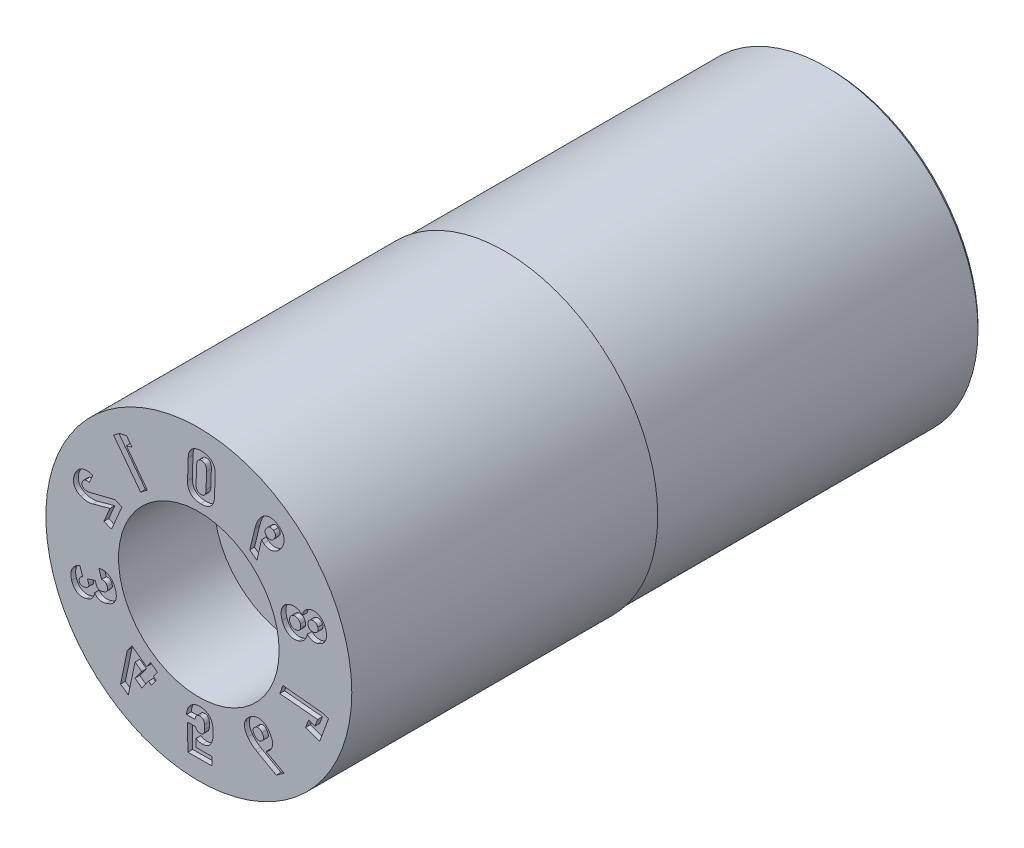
SolidWorks part; units mm, degrees
ref_plane "Front Plane" through (0, 0, 0) normal (0, 0, 1) x (1, 0, 0)
ref_plane "Top Plane" through (0, 0, 0) normal (0, 1, 0) x (1, 0, 0)
ref_plane "Right Plane" through (0, 0, 0) normal (1, 0, 0) x (0, 0, -1)
sketch "Sketch1" plane through (0, 0, 0) normal (1, 0, 0) x (0, 0, -1)
  line L2 (0, 8) -> (0, 4.2)
  line L3 (32.75, 8) -> (0, 8)
  line L4 (-3.7979, 0) -> (49996.2021, 0) construction
  line L8 (25, 1.75) -> (5, 1.75)
  line L9 (5, 4.2) -> (5, 1.75)
  line L10 (5, 4.2) -> (0, 4.2)
  line L12 (33, 4) -> (33, 7.75)
  line L16 (33, 7.75) -> (32.75, 8)
  line L17 (33, 4) -> (25, 4)
  line L18 (25, 1.75) -> (25, 4)
  dimension "D1" = 33
  dimension "D2" = 45
  dimension "D3" = 0.25
  dimension "D4" = 16
  dimension "D5" = 8.4
  dimension "D6" = 5
  dimension "D7" = 3.5
  dimension "D8" = 8
  dimension "D9" = 8
revolve "Revolve1" add sketch "Sketch1" angle 360 about L4
sketch "Sketch4" plane through (0, 0, 0) normal (1, 0, 0) x (0, 0, -1)
  line L0 (0, 0) -> (50000, 0) construction
  line L1 (33, -7.75) -> (33, 7.75) construction
  line L2 (16, 8.935) -> (33, 8.935)
  line L3 (16, 8.935) -> (16, 7.935)
  line L4 (16, 7.935) -> (33, 7.935)
  line L5 (33, 8.935) -> (33, 7.935)
  line L6 (32.75, 8) -> (0, 8) construction
  line L9 (0, 8.8) -> (0, -8.8) construction
  dimension "D1" = 1
  dimension "D2" = 0.065
  dimension "D3" = 16
revolve "Cut-Revolve1" cut sketch "Sketch4" angle 360 about L0
sketch "Sketch2" plane through (0, 0, 0) normal (0, 0, 1) x (1, 0, 0)
  line L0 (0, 0) -> (0, 9.8705) construction
  line L1 (0, 0) -> (5.8017, 7.9854) construction
  line L2 (0, 0) -> (9.3874, 3.0502) construction
  line L3 (0, 0) -> (9.3874, -3.0502) construction
  line L4 (0, 0) -> (5.8017, -7.9854) construction
  line L5 (0, 0) -> (0, -9.8705) construction
  line L6 (0, 0) -> (-5.8017, -7.9854) construction
  line L7 (0, 0) -> (-9.3874, -3.0502) construction
  line L8 (0, 0) -> (-9.3874, 3.0502) construction
  line L9 (0, 0) -> (-5.8017, 7.9854) construction
  line L10 (5.2105, 0.9555) -> (5.2468, 0.9678)
  line L11 (6.2049, 1.3375) -> (6.2628, 1.357)
  line L12 (5.8234, 2.6754) -> (5.7655, 2.6559)
  line L13 (4.7772, 2.3776) -> (4.7408, 2.3653)
  line L14 (4.9412, 1.9669) -> (4.9628, 1.9741)
  line L15 (5.1518, 1.4016) -> (5.1288, 1.3939)
  line L16 (5.8885, 2.2312) -> (5.9097, 2.2381)
  line L17 (6.0679, 1.7577) -> (6.0449, 1.75)
  line L18 (-2.7343, -4.1859) -> (-3.4994, -3.6238)
  line L19 (4.2834, 4.6581) -> (4.2845, 4.6594)
  line L20 (3.1715, 5.4731) -> (3.1707, 5.4723)
  line L21 (2.9229, 4.8591) -> (2.6616, 3.7971)
  line L22 (2.6616, 3.7971) -> (3.0391, 3.5179)
  line L23 (3.0391, 3.5179) -> (3.2791, 4.57)
  line L24 (3.54, 5.2247) -> (3.541, 5.2265)
  line L25 (3.9345, 4.9326) -> (3.9334, 4.9312)
  line L26 (0.8183, 5.2516) -> (0.8526, 6.3211)
  line L27 (-0.5549, 6.3667) -> (-0.5891, 5.2972)
  line L28 (-0.1422, 5.3963) -> (-0.1149, 6.239)
  line L29 (0.4057, 6.2224) -> (0.3784, 5.3797)
  line L30 (-3.0441, 3.5633) -> (-2.6908, 3.829)
  line L31 (-2.6908, 3.829) -> (-3.7895, 5.2888)
  line L32 (-3.7895, 5.2888) -> (-3.4964, 5.3743)
  line L33 (-3.4964, 5.3743) -> (-3.7789, 5.7494)
  line L34 (-3.7789, 5.7494) -> (-4.1539, 5.6655)
  line L35 (-4.1539, 5.6655) -> (-4.4556, 5.4383)
  line L36 (-4.4556, 5.4383) -> (-3.0441, 3.5633)
  line L37 (-4.3918, 2.551) -> (-5.6812, 2.2237)
  line L38 (-5.9891, 2.2302) -> (-5.9919, 2.2315)
  line L39 (-5.7263, 2.6573) -> (-5.7249, 2.6566)
  line L40 (-5.7249, 2.6566) -> (-5.5479, 3.0743)
  line L41 (-5.5479, 3.0743) -> (-5.5492, 3.075)
  line L42 (-6.1815, 1.8175) -> (-6.1801, 1.8168)
  line L43 (-5.5438, 1.7761) -> (-4.6458, 2.0224)
  line L44 (-4.6458, 2.0224) -> (-4.9596, 1.2842)
  line L45 (-4.9596, 1.2842) -> (-4.5673, 1.1175)
  line L46 (-4.5673, 1.1175) -> (-4.0247, 2.3951)
  line L47 (-4.0247, 2.3951) -> (-4.3918, 2.551)
  line L48 (-5.2305, -0.9771) -> (-5.0868, -1.4125)
  line L49 (-4.965, -1.9115) -> (-5.0178, -1.9286)
  line L50 (-5.3511, -1.8119) -> (-5.4138, -1.6222)
  line L51 (-5.4138, -1.6222) -> (-5.8203, -1.7563)
  line L52 (-5.8203, -1.7563) -> (-5.7577, -1.946)
  line L53 (-5.9335, -2.1893) -> (-5.9714, -2.2022)
  line L54 (-6.0754, -1.7774) -> (-6.2186, -1.3433)
  line L55 (-5.8659, -2.669) -> (-5.798, -2.6463)
  line L56 (-4.836, -2.371) -> (-4.7678, -2.3487)
  line L57 (-3.7405, -3.9523) -> (-4.0925, -5.6556)
  line L58 (-4.0925, -5.6556) -> (-3.6887, -5.9522)
  line L59 (-3.6887, -5.9522) -> (-3.3323, -4.2763)
  line L60 (-3.3323, -4.2763) -> (-2.9869, -4.5299)
  line L61 (-2.4816, -4.9011) -> (-2.2291, -4.557)
  line L62 (-2.2291, -4.557) -> (-2.3775, -4.448)
  line L63 (-3.4994, -3.6238) -> (-3.7405, -3.9523)
  line L64 (-3.3391, -5.0095) -> (-2.9824, -5.2717)
  line L65 (-2.9824, -5.2717) -> (-2.6301, -4.792)
  line L66 (-2.1632, -4.1563) -> (-2.5199, -3.894)
  line L67 (-2.5199, -3.894) -> (-2.7343, -4.1859)
  line L68 (-0.6419, -5.3092) -> (-0.6419, -5.3106)
  line L69 (-0.6419, -5.3106) -> (-0.1983, -5.3064)
  line L70 (-0.1983, -5.3064) -> (-0.1983, -5.3049)
  line L71 (0.2984, -5.3179) -> (0.3006, -5.515)
  line L72 (-0.1728, -5.6249) -> (-0.5872, -5.6291)
  line L73 (-0.5872, -5.6291) -> (-0.5745, -6.9821)
  line L74 (-0.5745, -6.9821) -> (0.6898, -6.9701)
  line L75 (0.6898, -6.9701) -> (0.6858, -6.5427)
  line L76 (0.6858, -6.5427) -> (-0.1348, -6.5505)
  line L77 (-0.1348, -6.5505) -> (-0.1385, -6.1347)
  line L78 (0.7437, -5.5108) -> (0.7416, -5.3137)
  line L79 (2.5522, -4.7219) -> (2.5532, -4.7233)
  line L80 (3.0678, -5.1612) -> (4.0497, -5.7117)
  line L81 (4.0497, -5.7117) -> (4.4602, -5.4187)
  line L82 (4.4602, -5.4187) -> (3.5177, -4.9024)
  line L84 (3.6846, -3.9264) -> (3.6836, -3.925)
  line L85 (3.305, -4.161) -> (3.306, -4.1623)
  line L86 (2.9039, -4.447) -> (2.9028, -4.4457)
  line L87 (6.5066, -1.6872) -> (4.3991, -1.4729)
  line L88 (4.3991, -1.4729) -> (4.2341, -1.9224)
  line L89 (4.2341, -1.9224) -> (6.2115, -2.1061)
  line L90 (6.2115, -2.1061) -> (6.0723, -2.4845)
  line L91 (6.0723, -2.4845) -> (5.7406, -2.363)
  line L92 (5.7406, -2.363) -> (5.5884, -2.7781)
  line L93 (5.5884, -2.7781) -> (6.3196, -3.0466)
  line L94 (6.3196, -3.0466) -> (6.7819, -1.7884)
  line L95 (6.7819, -1.7884) -> (6.5066, -1.6872)
  line L96 (-2.3775, -4.448) -> (-2.1632, -4.1563)
  line L97 (-2.6301, -4.792) -> (-2.4816, -4.9011)
  line L98 (-2.9869, -4.5299) -> (-3.3391, -5.0095)
  circle A0 centre (0, 0) radius 4.71 construction
  spline S0 degree 3 poles (4.3574, 1.4544) (4.3797, 1.3879) (4.4209, 1.2932) (4.494, 1.1805) (4.5555, 1.1086) (4.6224, 1.0465) (4.6958, 0.9968) (4.7735, 0.9581) (4.856, 0.9321) (4.942, 0.9182) (5.0622, 0.9166) (5.152, 0.9364) (5.2105, 0.9555) knots 0 0 0 0 0.189149 0.276864 0.361539 0.443576 0.522394 0.599725 0.677022 0.754789 0.833795 1 1 1 1
  spline S1 degree 3 poles (5.2468, 0.9678) (5.3018, 0.9857) (5.3802, 1.0246) (5.471, 1.0979) (5.5317, 1.1627) (5.5835, 1.2351) (5.6394, 1.3387) (5.6622, 1.4244) (5.6702, 1.4822) knots 0 0 0 0 0.246977 0.370172 0.497924 0.625566 0.750117 1 1 1 1
  spline S2 degree 3 poles (5.6702, 1.4822) (5.7052, 1.4465) (5.7644, 1.4002) (5.8533, 1.3555) (5.9234, 1.3313) (5.9952, 1.3165) (6.0903, 1.3104) (6.1606, 1.3229) (6.2049, 1.3375) knots 0 0 0 0 0.257134 0.383027 0.511099 0.637625 0.759671 1 1 1 1
  spline S3 degree 3 poles (6.2628, 1.357) (6.3178, 1.3758) (6.3968, 1.4114) (6.4866, 1.4806) (6.5434, 1.5398) (6.5917, 1.6057) (6.6286, 1.6787) (6.6558, 1.7572) (6.6717, 1.8412) (6.6777, 1.9295) (6.6704, 2.0549) (6.6472, 2.1487) (6.6268, 2.2107) knots 0 0 0 0 0.16714 0.246142 0.324291 0.402157 0.479801 0.558525 0.640149 0.724487 0.812253 1 1 1 1
  spline S4 degree 3 poles (6.6268, 2.2107) (6.6058, 2.2726) (6.5682, 2.3617) (6.4987, 2.4665) (6.4411, 2.5337) (6.3778, 2.5912) (6.309, 2.6376) (6.2355, 2.6735) (6.1577, 2.6978) (6.0765, 2.7108) (5.9633, 2.7116) (5.8785, 2.6938) (5.8234, 2.6754) knots 0 0 0 0 0.188263 0.275658 0.360332 0.441745 0.520456 0.597882 0.675873 0.753814 0.833078 1 1 1 1
  spline S5 degree 3 poles (5.7655, 2.6559) (5.7201, 2.6417) (5.6568, 2.6076) (5.5827, 2.5461) (5.5347, 2.4901) (5.4932, 2.4284) (5.4505, 2.338) (5.4317, 2.265) (5.4262, 2.2149) knots 0 0 0 0 0.242123 0.364086 0.490249 0.617698 0.743096 1 1 1 1
  spline S6 degree 3 poles (5.4262, 2.2149) (5.3847, 2.2572) (5.3141, 2.3122) (5.2067, 2.3632) (5.1217, 2.3905) (5.0345, 2.4065) (4.918, 2.4112) (4.832, 2.3955) (4.7772, 2.3776) knots 0 0 0 0 0.252199 0.377454 0.505058 0.631379 0.754394 1 1 1 1
  spline S7 degree 3 poles (4.7408, 2.3653) (4.6824, 2.3455) (4.5989, 2.3072) (4.5034, 2.234) (4.4432, 2.1711) (4.3926, 2.1008) (4.3534, 2.0234) (4.3256, 1.9395) (4.308, 1.85) (4.3024, 1.7555) (4.3112, 1.6213) (4.335, 1.5208) (4.3574, 1.4544) knots 0 0 0 0 0.166586 0.245064 0.32325 0.400569 0.477895 0.55635 0.638171 0.723193 0.810971 1 1 1 1
  spline S8 degree 3 poles (4.7615, 1.5889) (4.7527, 1.6154) (4.7432, 1.6561) (4.7418, 1.7104) (4.7449, 1.7493) (4.7537, 1.7864) (4.7671, 1.8214) (4.7859, 1.8537) (4.8088, 1.8835) (4.8364, 1.9103) (4.8792, 1.9412) (4.9153, 1.959) (4.9412, 1.9669) knots 0 0 0 0 0.178659 0.263512 0.345804 0.426862 0.506071 0.58371 0.664092 0.745271 0.827853 1 1 1 1
  spline S9 degree 3 poles (4.9628, 1.9741) (4.9864, 1.982) (5.0229, 1.9896) (5.0715, 1.9883) (5.1063, 1.9823) (5.1397, 1.9714) (5.1714, 1.9558) (5.2009, 1.9356) (5.2285, 1.9112) (5.253, 1.882) (5.2837, 1.8372) (5.2996, 1.7984) (5.3088, 1.7715) knots 0 0 0 0 0.166218 0.24509 0.322722 0.400755 0.478423 0.557267 0.638758 0.723097 0.810568 1 1 1 1
  spline S10 degree 3 poles (5.3088, 1.7715) (5.3174, 1.7446) (5.328, 1.7041) (5.3306, 1.6498) (5.3279, 1.6116) (5.3213, 1.5751) (5.3095, 1.5409) (5.2933, 1.5093) (5.2726, 1.4806) (5.2481, 1.4548) (5.2094, 1.425) (5.1756, 1.4093) (5.1518, 1.4016) knots 0 0 0 0 0.188381 0.275514 0.359781 0.441669 0.521149 0.598996 0.676873 0.75539 0.833936 1 1 1 1
  spline S11 degree 3 poles (5.1288, 1.3939) (5.1031, 1.3854) (5.0639, 1.3769) (5.0113, 1.376) (4.9738, 1.3815) (4.9379, 1.3917) (4.904, 1.4066) (4.8723, 1.4261) (4.8438, 1.451) (4.8177, 1.4797) (4.7879, 1.5248) (4.7699, 1.562) (4.7615, 1.5889) knots 0 0 0 0 0.173702 0.255121 0.336326 0.416102 0.493685 0.572899 0.653754 0.736097 0.820278 1 1 1 1
  spline S12 degree 3 poles (5.7158, 1.907) (5.7081, 1.9296) (5.7004, 1.9643) (5.6999, 2.0105) (5.7041, 2.0435) (5.7132, 2.0748) (5.7258, 2.1046) (5.7436, 2.1322) (5.7649, 2.1581) (5.7909, 2.1809) (5.8308, 2.2083) (5.8645, 2.2237) (5.8885, 2.2312) knots 0 0 0 0 0.173002 0.255064 0.334564 0.413146 0.490488 0.568625 0.649591 0.733329 0.818008 1 1 1 1
  spline S13 degree 3 poles (5.9097, 2.2381) (5.932, 2.2453) (5.9658, 2.2532) (6.011, 2.2539) (6.0429, 2.2502) (6.0732, 2.2416) (6.1019, 2.2293) (6.1287, 2.2132) (6.153, 2.1925) (6.1751, 2.1687) (6.2018, 2.1311) (6.2153, 2.0985) (6.2234, 2.0761) knots 0 0 0 0 0.177307 0.259345 0.339545 0.418685 0.496491 0.574446 0.653742 0.736205 0.819476 1 1 1 1
  spline S14 degree 3 poles (6.2234, 2.0761) (6.2305, 2.0534) (6.2396, 2.0189) (6.2401, 1.9728) (6.2372, 1.9402) (6.2295, 1.9092) (6.2183, 1.8799) (6.2023, 1.8528) (6.1821, 1.8283) (6.1587, 1.8058) (6.1221, 1.7789) (6.09, 1.7654) (6.0679, 1.7577) knots 0 0 0 0 0.179779 0.264113 0.345718 0.425073 0.502738 0.58081 0.660047 0.741093 0.823978 1 1 1 1
  spline S15 degree 3 poles (6.0449, 1.75) (6.0217, 1.7424) (5.9861, 1.7341) (5.9386, 1.7326) (5.9047, 1.7354) (5.8727, 1.7432) (5.8423, 1.7547) (5.8143, 1.7707) (5.7884, 1.7906) (5.7651, 1.8143) (5.7379, 1.8519) (5.7236, 1.8845) (5.7158, 1.907) knots 0 0 0 0 0.179106 0.264699 0.346614 0.427117 0.504294 0.583324 0.662147 0.74231 0.825294 1 1 1 1
  spline S16 degree 3 poles (3.2791, 4.57) (3.2803, 4.5683) (3.2912, 4.5538) (3.3251, 4.5129) (3.3653, 4.4807) (3.3927, 4.4592) knots 0.563786 0.563786 0.563786 0.563786 0.581129 0.712436 1 1 1 1
  spline S17 degree 3 poles (3.3927, 4.4592) (3.438, 4.4258) (3.5108, 4.3842) (3.6159, 4.3515) (3.6952, 4.3396) (3.7752, 4.3396) (3.8548, 4.3514) (3.933, 4.3753) (4.0101, 4.4101) (4.0846, 4.4565) (4.182, 4.534) (4.2444, 4.6065) (4.2834, 4.6581) knots 0 0 0 0 0.164675 0.242727 0.320504 0.398278 0.475826 0.554827 0.636812 0.722299 0.810668 1 1 1 1
  spline S18 degree 3 poles (4.2845, 4.6594) (4.3264, 4.7166) (4.3813, 4.8049) (4.4311, 4.9297) (4.4535, 5.0199) (4.4627, 5.1087) (4.4592, 5.1955) (4.4411, 5.2797) (4.4105, 5.3614) (4.3662, 5.4397) (4.2884, 5.5429) (4.2133, 5.6089) (4.159, 5.6495) knots 0 0 0 0 0.187627 0.273057 0.354401 0.432446 0.508422 0.583131 0.659365 0.73805 0.820288 1 1 1 1
  spline S19 degree 3 poles (4.159, 5.6495) (4.1044, 5.6895) (4.0194, 5.7414) (3.8981, 5.7853) (3.8098, 5.8036) (3.7222, 5.8087) (3.6358, 5.8006) (3.5512, 5.7784) (3.4688, 5.7426) (3.3888, 5.694) (3.2829, 5.6095) (3.2137, 5.5307) (3.1715, 5.4731) knots 0 0 0 0 0.17842 0.259907 0.338646 0.414955 0.490155 0.565992 0.644313 0.725878 0.8117 1 1 1 1
  spline S20 degree 3 poles (3.1707, 5.4723) (3.1457, 5.4395) (3.1129, 5.3855) (3.0731, 5.3089) (3.0452, 5.2455) (3.019, 5.1781) (2.984, 5.0805) (2.9617, 5.0042) (2.947, 4.9518) knots 0 0 0 0 0.216978 0.332495 0.454245 0.58128 0.71365 1 1 1 1
  spline S21 degree 3 poles (2.947, 4.9518) (2.9429, 4.9362) (2.9335, 4.9056) (2.9257, 4.8746) (2.9229, 4.8591) knots 0 0 0 0 0.506509 1 1 1 1
  spline S22 degree 3 poles (3.5652, 4.8475) (3.5374, 4.8686) (3.4992, 4.9053) (3.4717, 4.9674) (3.4625, 5.0158) (3.4647, 5.0669) (3.4856, 5.1401) (3.5153, 5.1918) (3.54, 5.2247) knots 0 0 0 0 0.246661 0.358169 0.470659 0.588071 0.712166 1 1 1 1
  spline S23 degree 3 poles (3.541, 5.2265) (3.5641, 5.2585) (3.6036, 5.3007) (3.6666, 5.3387) (3.7137, 5.3543) (3.7616, 5.3591) (3.8285, 5.3492) (3.8745, 5.324) (3.9028, 5.3032) knots 0 0 0 0 0.283144 0.406478 0.521911 0.635081 0.747534 1 1 1 1
  spline S24 degree 3 poles (3.9028, 5.3032) (3.9308, 5.2819) (3.9695, 5.2454) (3.9977, 5.1834) (4.0073, 5.1359) (4.0053, 5.0861) (3.988, 5.0144) (3.9573, 4.9648) (3.9345, 4.9326) knots 0 0 0 0 0.252622 0.366078 0.47914 0.594487 0.717256 1 1 1 1
  spline S25 degree 3 poles (3.9334, 4.9312) (3.9085, 4.899) (3.8693, 4.8538) (3.8047, 4.8141) (3.757, 4.7972) (3.7081, 4.7915) (3.6406, 4.8021) (3.5935, 4.8258) (3.5652, 4.8475) knots 0 0 0 0 0.287026 0.410457 0.526867 0.638521 0.751095 1 1 1 1
  spline S26 degree 3 poles (0.0927, 4.6061) (0.1468, 4.6047) (0.2261, 4.6062) (0.3277, 4.6219) (0.3967, 4.6394) (0.4608, 4.6622) (0.5202, 4.6908) (0.5745, 4.7251) (0.6235, 4.7654) (0.6669, 4.8107) (0.7052, 4.8606) (0.7382, 4.9148) (0.7655, 4.9736) (0.7872, 5.0369) (0.8088, 5.1295) (0.8169, 5.202) (0.8183, 5.2516) knots 0 0 0 0 0.147137 0.214358 0.278606 0.339919 0.398926 0.456935 0.513792 0.570649 0.626987 0.684089 0.742428 0.802687 0.865483 1 1 1 1
  spline S27 degree 3 poles (0.8526, 6.3211) (0.8537, 6.371) (0.8524, 6.4447) (0.8354, 6.539) (0.8179, 6.6038) (0.795, 6.6646) (0.7656, 6.7209) (0.7307, 6.7731) (0.6895, 6.8204) (0.643, 6.8633) (0.591, 6.9009) (0.5336, 6.9329) (0.4714, 6.9601) (0.4037, 6.9813) (0.3034, 7.0027) (0.2247, 7.0102) (0.1707, 7.0121) knots 0 0 0 0 0.135819 0.198843 0.259322 0.317796 0.3747 0.43116 0.487607 0.544517 0.602364 0.661319 0.722276 0.78613 0.853499 1 1 1 1
  spline S28 degree 3 poles (0.1707, 7.0121) (0.1166, 7.0134) (0.0372, 7.0123) (-0.0641, 6.9959) (-0.1334, 6.9801) (-0.1972, 6.9568) (-0.2567, 6.9289) (-0.3109, 6.895) (-0.3598, 6.8553) (-0.4036, 6.8106) (-0.4422, 6.7613) (-0.4745, 6.7067) (-0.5021, 6.6479) (-0.5235, 6.5841) (-0.5466, 6.4907) (-0.5527, 6.4169) (-0.5549, 6.3667) knots 0 0 0 0 0.146922 0.214045 0.277959 0.339182 0.3979 0.455579 0.512067 0.568196 0.624703 0.681512 0.739766 0.800352 0.863566 1 1 1 1
  spline S29 degree 3 poles (-0.5891, 5.2972) (-0.5903, 5.2472) (-0.589, 5.1735) (-0.572, 5.0792) (-0.5545, 5.0145) (-0.5315, 4.9538) (-0.5017, 4.8978) (-0.4666, 4.8456) (-0.4257, 4.7978) (-0.3791, 4.7551) (-0.3275, 4.7171) (-0.2701, 4.6852) (-0.2076, 4.6582) (-0.1399, 4.6369) (-0.0399, 4.6155) (0.0387, 4.6081) (0.0927, 4.6061) knots 0 0 0 0 0.135853 0.198892 0.259386 0.317476 0.37461 0.431085 0.487863 0.544787 0.602288 0.661258 0.722634 0.786504 0.853463 1 1 1 1
  spline S30 degree 3 poles (0.1066, 5.0332) (0.0857, 5.0347) (0.0548, 5.0368) (0.0167, 5.0488) (-0.0092, 5.059) (-0.0321, 5.0734) (-0.0536, 5.0894) (-0.0718, 5.1091) (-0.094, 5.1391) (-0.1153, 5.1843) (-0.1417, 5.2723) (-0.1425, 5.3457) (-0.1422, 5.3963) knots 0 0 0 0 0.125945 0.183291 0.238413 0.291967 0.344823 0.3983 0.452118 0.567781 0.695223 1 1 1 1
  spline S31 degree 3 poles (-0.1149, 6.239) (-0.1127, 6.2895) (-0.1063, 6.3625) (-0.0751, 6.4488) (-0.0502, 6.4923) (-0.0262, 6.5207) (-0.0067, 6.5393) (0.0158, 6.5538) (0.0395, 6.567) (0.066, 6.5757) (0.105, 6.584) (0.1358, 6.5862) (0.1569, 6.585) knots 0 0 0 0 0.304248 0.431958 0.547131 0.601686 0.654466 0.707868 0.761045 0.816491 0.873821 1 1 1 1
  spline S32 degree 3 poles (0.1569, 6.585) (0.178, 6.585) (0.2083, 6.5805) (0.247, 6.5703) (0.2724, 6.5588) (0.2963, 6.5459) (0.3167, 6.5286) (0.3356, 6.5095) (0.3576, 6.4793) (0.3795, 6.4344) (0.4045, 6.3461) (0.4063, 6.2731) (0.4057, 6.2224) knots 0 0 0 0 0.126048 0.183166 0.238633 0.292583 0.345235 0.398052 0.45322 0.568053 0.695199 1 1 1 1
  spline S33 degree 3 poles (0.3784, 5.3797) (0.3765, 5.329) (0.3691, 5.2564) (0.3392, 5.1694) (0.3141, 5.126) (0.2902, 5.0972) (0.2701, 5.0793) (0.2482, 5.064) (0.2238, 5.0521) (0.1976, 5.0423) (0.1583, 5.0344) (0.1277, 5.0319) (0.1066, 5.0332) knots 0 0 0 0 0.303869 0.432041 0.54707 0.601557 0.654952 0.707519 0.76099 0.81672 0.873978 1 1 1 1
  spline S34 degree 3 poles (-5.6812, 2.2237) (-5.7357, 2.2092) (-5.8053, 2.2008) (-5.887, 2.2051) (-5.9345, 2.212) (-5.9684, 2.2211) (-5.9891, 2.2302) knots 0 0 0 0 0.540417 0.66529 0.783623 1 1 1 1
  spline S35 degree 3 poles (-5.9919, 2.2315) (-6.018, 2.2432) (-6.0553, 2.265) (-6.0892, 2.3091) (-6.105, 2.3458) (-6.1127, 2.3866) (-6.1101, 2.4486) (-6.096, 2.4952) (-6.0827, 2.5259) knots 0 0 0 0 0.247379 0.359452 0.471475 0.587843 0.711996 1 1 1 1
  spline S36 degree 3 poles (-6.0827, 2.5259) (-6.0698, 2.5571) (-6.0425, 2.6001) (-5.991, 2.6417) (-5.9471, 2.6635) (-5.8979, 2.6764) (-5.8228, 2.6792) (-5.7649, 2.6697) (-5.7263, 2.6573) knots 0 0 0 0 0.240301 0.353602 0.467626 0.586428 0.712064 1 1 1 1
  spline S37 degree 3 poles (-5.5492, 3.075) (-5.6144, 3.0974) (-5.7128, 3.1232) (-5.8446, 3.1322) (-5.9374, 3.1274) (-6.0258, 3.111) (-6.109, 3.083) (-6.1866, 3.0441) (-6.2585, 2.9944) (-6.3237, 2.934) (-6.4026, 2.8382) (-6.4486, 2.7551) (-6.4736, 2.696) knots 0 0 0 0 0.18554 0.271456 0.354226 0.434575 0.512418 0.589478 0.667282 0.746436 0.827565 1 1 1 1
  spline S38 degree 3 poles (-6.4736, 2.696) (-6.4996, 2.6331) (-6.5323, 2.539) (-6.553, 2.4121) (-6.5563, 2.324) (-6.5487, 2.2404) (-6.5289, 2.1618) (-6.4978, 2.0886) (-6.4558, 2.0207) (-6.4024, 1.9595) (-6.3157, 1.8831) (-6.2365, 1.8419) (-6.1815, 1.8175) knots 0 0 0 0 0.194455 0.282717 0.366022 0.445417 0.521556 0.596459 0.671496 0.748381 0.827478 1 1 1 1
  spline S39 degree 3 poles (-6.1801, 1.8168) (-6.131, 1.7964) (-6.0544, 1.7708) (-5.9482, 1.7517) (-5.8664, 1.7434) (-5.7842, 1.7418) (-5.6757, 1.7472) (-5.5957, 1.762) (-5.5438, 1.7761) knots 0 0 0 0 0.246111 0.371563 0.498179 0.625725 0.751299 1 1 1 1
  spline S40 degree 3 poles (-4.3671, -1.4882) (-4.3889, -1.4241) (-4.4275, -1.3314) (-4.499, -1.2216) (-4.5584, -1.1497) (-4.6242, -1.0873) (-4.6968, -1.0362) (-4.775, -0.9955) (-4.8588, -0.9666) (-4.9472, -0.9493) (-5.0728, -0.943) (-5.1679, -0.9596) (-5.2305, -0.9771) knots 0 0 0 0 0.181223 0.266564 0.349546 0.430082 0.508369 0.586204 0.664928 0.74459 0.826146 1 1 1 1
  spline S41 degree 3 poles (-5.0868, -1.4125) (-5.0641, -1.4085) (-5.0302, -1.4044) (-4.9862, -1.4078) (-4.9557, -1.4137) (-4.9273, -1.4234) (-4.9006, -1.4354) (-4.8766, -1.4516) (-4.8548, -1.4706) (-4.8346, -1.4923) (-4.8119, -1.5271) (-4.7981, -1.5557) (-4.792, -1.5765) knots 0 0 0 0 0.185748 0.272261 0.354289 0.434903 0.513133 0.589187 0.66662 0.745335 0.826522 1 1 1 1
  spline S42 degree 3 poles (-4.792, -1.5765) (-4.7804, -1.6124) (-4.7692, -1.6672) (-4.7783, -1.7384) (-4.7965, -1.7848) (-4.8239, -1.8267) (-4.8775, -1.8754) (-4.9281, -1.9001) (-4.965, -1.9115) knots 0 0 0 0 0.265367 0.383295 0.497319 0.611999 0.730055 1 1 1 1
  spline S43 degree 3 poles (-5.0178, -1.9286) (-5.0557, -1.941) (-5.1119, -1.9537) (-5.185, -1.9532) (-5.2318, -1.9425) (-5.2725, -1.9227) (-5.32, -1.8839) (-5.3414, -1.8414) (-5.3511, -1.8119) knots 0 0 0 0 0.299915 0.427846 0.54548 0.656508 0.764742 1 1 1 1
  spline S44 degree 3 poles (-5.7577, -1.946) (-5.749, -1.9702) (-5.7449, -2.0086) (-5.7575, -2.0579) (-5.7776, -2.0908) (-5.8045, -2.1217) (-5.8554, -2.1586) (-5.9005, -2.1788) (-5.9335, -2.1893) knots 0 0 0 0 0.226218 0.333379 0.445244 0.565053 0.694043 1 1 1 1
  spline S45 degree 3 poles (-5.9714, -2.2022) (-6.0022, -2.212) (-6.0484, -2.2231) (-6.1085, -2.2183) (-6.1473, -2.2075) (-6.1812, -2.1883) (-6.2213, -2.1523) (-6.2395, -2.1144) (-6.2483, -2.0881) knots 0 0 0 0 0.287532 0.411515 0.52875 0.640764 0.752688 1 1 1 1
  spline S46 degree 3 poles (-6.2483, -2.0881) (-6.2544, -2.0698) (-6.2598, -2.0413) (-6.2584, -2.003) (-6.2539, -1.9745) (-6.2444, -1.9463) (-6.2318, -1.9187) (-6.2145, -1.8924) (-6.1946, -1.8664) (-6.1704, -1.8417) (-6.1312, -1.8105) (-6.0988, -1.7896) (-6.0754, -1.7774) knots 0 0 0 0 0.148997 0.220967 0.295265 0.371679 0.449586 0.529695 0.613891 0.702468 0.796389 1 1 1 1
  spline S47 degree 3 poles (-6.2186, -1.3433) (-6.2807, -1.371) (-6.37, -1.4181) (-6.4719, -1.501) (-6.5368, -1.5678) (-6.5908, -1.6402) (-6.6337, -1.7172) (-6.6653, -1.7984) (-6.6854, -1.8833) (-6.6944, -1.9708) (-6.6903, -2.091) (-6.6719, -2.1804) (-6.6525, -2.2385) knots 0 0 0 0 0.185257 0.272212 0.356117 0.437851 0.516895 0.595088 0.673898 0.753528 0.833513 1 1 1 1
  spline S48 degree 3 poles (-6.6525, -2.2385) (-6.6372, -2.2854) (-6.6106, -2.3528) (-6.5655, -2.4353) (-6.5292, -2.4898) (-6.4894, -2.5382) (-6.4468, -2.5814) (-6.4001, -2.618) (-6.3505, -2.6494) (-6.2979, -2.6743) (-6.2427, -2.6928) (-6.1853, -2.7049) (-6.1256, -2.7111) (-6.0638, -2.7097) (-5.9758, -2.7007) (-5.9101, -2.6828) (-5.8659, -2.669) knots 0 0 0 0 0.145044 0.212121 0.276185 0.337319 0.396086 0.454226 0.511331 0.568298 0.624876 0.682232 0.74042 0.800866 0.863745 1 1 1 1
  spline S49 degree 3 poles (-5.798, -2.6463) (-5.749, -2.6302) (-5.6789, -2.5979) (-5.6008, -2.5341) (-5.5515, -2.4798) (-5.5111, -2.4185) (-5.4709, -2.3259) (-5.4561, -2.2504) (-5.4539, -2.1987) knots 0 0 0 0 0.257595 0.378617 0.499924 0.621249 0.742703 1 1 1 1
  spline S50 degree 3 poles (-5.4539, -2.1987) (-5.4399, -2.2233) (-5.4147, -2.2567) (-5.3768, -2.2967) (-5.3465, -2.3229) (-5.3134, -2.3453) (-5.2789, -2.3656) (-5.2415, -2.3813) (-5.2023, -2.3945) (-5.1612, -2.4037) (-5.1186, -2.4101) (-5.0745, -2.4122) (-5.0293, -2.4106) (-4.9828, -2.4067) (-4.9177, -2.3948) (-4.8686, -2.3824) (-4.836, -2.371) knots 0 0 0 0 0.121016 0.179007 0.236491 0.292716 0.349953 0.408025 0.466854 0.527323 0.588488 0.651774 0.716171 0.782822 0.85191 1 1 1 1
  spline S51 degree 3 poles (-4.7678, -2.3487) (-4.7073, -2.3282) (-4.6206, -2.2914) (-4.5209, -2.2215) (-4.4588, -2.1634) (-4.407, -2.0988) (-4.3667, -2.0273) (-4.3378, -1.9497) (-4.3202, -1.8664) (-4.3148, -1.7779) (-4.3221, -1.6495) (-4.3457, -1.5527) (-4.3671, -1.4882) knots 0 0 0 0 0.178009 0.25946 0.337643 0.413675 0.488995 0.564882 0.643113 0.725018 0.810737 1 1 1 1
  spline S52 degree 3 poles (0.0406, -4.5978) (-0.0199, -4.5982) (-0.1096, -4.6087) (-0.2223, -4.6453) (-0.3, -4.683) (-0.3722, -4.7296) (-0.4362, -4.7873) (-0.4934, -4.8536) (-0.5415, -4.9298) (-0.582, -5.0137) (-0.6235, -5.1395) (-0.638, -5.2403) (-0.6419, -5.3092) knots 0 0 0 0 0.165435 0.244453 0.322811 0.400721 0.478452 0.557334 0.639213 0.72378 0.811352 1 1 1 1
  spline S53 degree 3 poles (-0.1983, -5.3049) (-0.1952, -5.2655) (-0.1838, -5.2091) (-0.1523, -5.1422) (-0.1224, -5.102) (-0.0871, -5.069) (-0.0303, -5.0373) (0.0183, -5.028) (0.0514, -5.0284) knots 0 0 0 0 0.286829 0.412864 0.53279 0.648654 0.760742 1 1 1 1
  spline S54 degree 3 poles (0.0514, -5.0284) (0.0864, -5.0278) (0.1387, -5.0355) (0.1982, -5.0688) (0.2345, -5.1026) (0.2634, -5.1449) (0.2914, -5.2165) (0.2982, -5.2763) (0.2984, -5.3179) knots 0 0 0 0 0.244808 0.356914 0.469345 0.586507 0.710375 1 1 1 1
  spline S55 degree 3 poles (0.3006, -5.515) (0.3011, -5.5565) (0.2956, -5.6161) (0.272, -5.6881) (0.247, -5.7306) (0.2156, -5.765) (0.1629, -5.7979) (0.1163, -5.8074) (0.0848, -5.8073) knots 0 0 0 0 0.303507 0.432923 0.550996 0.661756 0.769799 1 1 1 1
  spline S56 degree 3 poles (0.0848, -5.8073) (0.0549, -5.808) (0.011, -5.8024) (-0.0432, -5.7826) (-0.0789, -5.7612) (-0.1106, -5.7347) (-0.1465, -5.6913) (-0.1648, -5.6525) (-0.1728, -5.6249) knots 0 0 0 0 0.262654 0.38531 0.506083 0.627837 0.747048 1 1 1 1
  spline S57 degree 3 poles (-0.1385, -6.1347) (-0.1206, -6.1513) (-0.0896, -6.1739) (-0.0418, -6.1962) (0.0396, -6.226) (0.1129, -6.2366) (0.1713, -6.2365) knots 0 0 0 0 0.220421 0.342771 0.474065 1 1 1 1
  spline S58 degree 3 poles (0.1713, -6.2365) (0.2284, -6.2358) (0.3128, -6.2268) (0.4161, -6.1889) (0.485, -6.1516) (0.5461, -6.1032) (0.5996, -6.0453) (0.6448, -5.9774) (0.6824, -5.9007) (0.7106, -5.8147) (0.7388, -5.6847) (0.744, -5.5815) (0.7437, -5.5108) knots 0 0 0 0 0.163871 0.239866 0.313778 0.387291 0.462075 0.538647 0.619918 0.705916 0.797177 1 1 1 1
  spline S59 degree 3 poles (0.7416, -5.3137) (0.7413, -5.2427) (0.7316, -5.1392) (0.6959, -5.0097) (0.6592, -4.9243) (0.6127, -4.8479) (0.5565, -4.7813) (0.4915, -4.7243) (0.4174, -4.6772) (0.3345, -4.641) (0.2095, -4.6047) (0.109, -4.5974) (0.0406, -4.5978) knots 0 0 0 0 0.187127 0.27203 0.353069 0.431236 0.506694 0.581838 0.658127 0.73709 0.819561 1 1 1 1
  spline S60 degree 3 poles (2.7008, -3.7393) (2.6451, -3.7784) (2.5697, -3.8438) (2.4891, -3.9448) (2.4439, -4.0227) (2.4112, -4.1037) (2.3913, -4.1875) (2.3855, -4.2737) (2.3926, -4.3618) (2.4129, -4.4515) (2.4587, -4.5764) (2.5117, -4.6647) (2.5522, -4.7219) knots 0 0 0 0 0.180656 0.263129 0.342419 0.418979 0.494494 0.569998 0.647621 0.728611 0.813506 1 1 1 1
  spline S61 degree 3 poles (2.5532, -4.7233) (2.5788, -4.7593) (2.6213, -4.8116) (2.6844, -4.8776) (2.7921, -4.9791) (2.8926, -5.0539) (2.9775, -5.1079) knots 0 0 0 0 0.229946 0.350248 0.475808 1 1 1 1
  spline S62 degree 3 poles (2.9775, -5.1079) (2.9923, -5.1177) (3.0223, -5.1356) (3.0524, -5.1535) (3.0678, -5.1612) knots 0 0 0 0 0.506804 1 1 1 1
  spline S63 degree 3 poles (3.5177, -4.9024) (3.5442, -4.8906) (3.5693, -4.8757) (3.5929, -4.8589) knots 0.757914 0.757914 0.757914 0.757914 1 1 1 1
  spline S64 degree 3 poles (3.5929, -4.8589) (3.6422, -4.8235) (3.7104, -4.765) (3.7791, -4.6712) (3.8183, -4.5992) (3.8444, -4.5231) (3.8584, -4.4438) (3.8599, -4.3616) (3.8491, -4.2768) (3.8256, -4.1903) (3.7774, -4.069) (3.7249, -3.9825) (3.6846, -3.9264) knots 0 0 0 0 0.171478 0.250462 0.326797 0.401631 0.476416 0.55298 0.63262 0.716514 0.805116 1 1 1 1
  spline S65 degree 3 poles (3.6836, -3.925) (3.6419, -3.8679) (3.5757, -3.7876) (3.4718, -3.7024) (3.3931, -3.653) (3.3111, -3.617) (3.2272, -3.594) (3.1412, -3.5845) (3.0537, -3.5887) (2.9652, -3.6066) (2.8424, -3.6483) (2.7566, -3.7006) (2.7008, -3.7393) knots 0 0 0 0 0.187035 0.272209 0.353663 0.43158 0.507658 0.582381 0.658921 0.737725 0.820163 1 1 1 1
  spline S66 degree 3 poles (2.9501, -4.089) (2.979, -4.0685) (3.0253, -4.0432) (3.0922, -4.033) (3.1397, -4.0374) (3.1858, -4.0523) (3.2459, -4.0895) (3.2833, -4.13) (3.305, -4.161) knots 0 0 0 0 0.2597 0.374848 0.488723 0.604066 0.724492 1 1 1 1
  spline S67 degree 3 poles (3.306, -4.1623) (3.3304, -4.198) (3.3635, -4.2521) (3.3829, -4.3295) (3.3865, -4.3821) (3.3775, -4.432) (3.3487, -4.495) (3.3109, -4.5332) (3.2815, -4.5535) knots 0 0 0 0 0.294014 0.419809 0.536102 0.647422 0.758084 1 1 1 1
  spline S68 degree 3 poles (3.2815, -4.5535) (3.2528, -4.574) (3.205, -4.5977) (3.1362, -4.6033) (3.0861, -4.5947) (3.0366, -4.5747) (2.9702, -4.53) (2.929, -4.4821) (2.9039, -4.447) knots 0 0 0 0 0.239771 0.349151 0.461941 0.579886 0.707249 1 1 1 1
  spline S69 degree 3 poles (2.9028, -4.4457) (2.8812, -4.4151) (2.8532, -4.3671) (2.8396, -4.298) (2.84, -4.25) (2.8521, -4.2043) (2.883, -4.1449) (2.9218, -4.1097) (2.9501, -4.089) knots 0 0 0 0 0.277055 0.397337 0.51304 0.625909 0.741004 1 1 1 1
  point P15 (0, 0)
  dimension "D1" = 10
extrude "Cut-Extrude1" cut sketch "Sketch2" against normal blind 0.25
sketch "Sketch3" plane through (0, 0, -5) normal (0, 0, 1) x (1, 0, 0)
  line L0 (0, 0) -> (0, 50000) construction
  line L1 (1.0104, 1.75) -> (-1.0104, 1.75)
  line L2 (-1.0104, 1.75) -> (-2.0207, 0)
  line L3 (-2.0207, 0) -> (-1.0104, -1.75)
  line L4 (-1.0104, -1.75) -> (1.0104, -1.75)
  line L5 (1.0104, -1.75) -> (2.0207, 0)
  line L6 (2.0207, 0) -> (1.0104, 1.75)
  line L7 (0, 0) -> (50000, 0) construction
  circle A0 centre (0, 0) radius 1.75 construction
  circle A1 centre (0, 0) radius 1.75 construction
extrude "Cut-Extrude2" cut sketch "Sketch3" against normal blind 4
